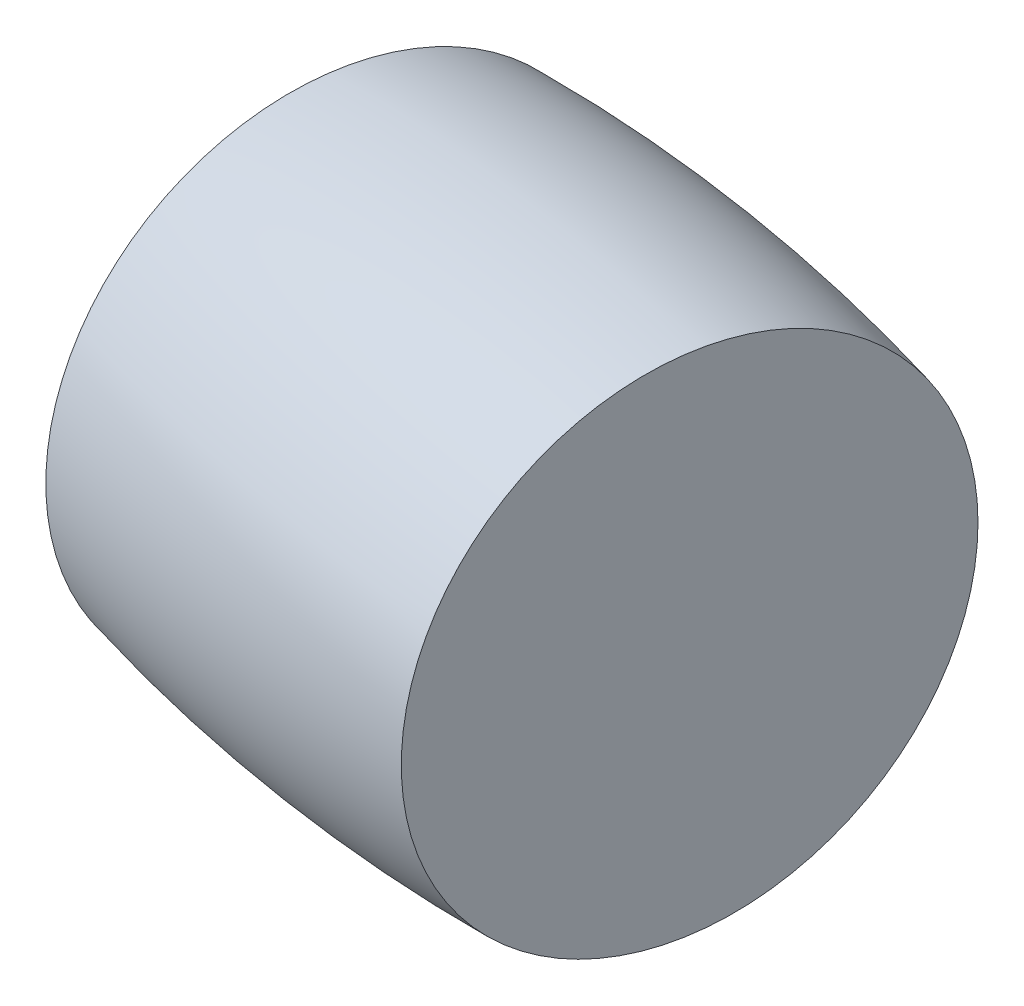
SolidWorks part; units mm, degrees
ref_plane "Plan1" through (0, 0, 0) normal (0, 0, 1) x (1, 0, 0)
ref_plane "Plan2" through (0, 0, 0) normal (0, 1, 0) x (1, 0, 0)
ref_plane "Plan3" through (0, 0, 0) normal (1, 0, 0) x (0, 0, -1)
sketch "Esquisse1" plane through (0, 0, 0) normal (0, 1, 0) x (1, 0, 0)
  line L1 (0, 0) -> (-10, 1.5713) construction
  line L4 (-10, -8.6421) -> (-6.8677, 11.2925) construction
  line L5 (6.8677, -11.2925) -> (10, 8.6421) construction
  line L6 (8.4339, -1.3252) -> (-10, 1.5713) construction
  line L8 (-8.4339, 1.3252) -> (-6.8677, 11.2925)
  line L9 (8.4339, -1.3252) -> (10, 8.6421)
  line L10 (-8.4339, 1.3252) -> (8.4339, -1.3252)
  arc A1 (10, 8.6421) -> (-30, 8.6421) centre (-10, -63.6421) ccw construction
  arc A2 (10, 8.6421) -> (-6.8677, 11.2925) centre (-10, -63.6421) ccw
revolve "Base-Révolution" add sketch "Esquisse1" angle 360 about L6
